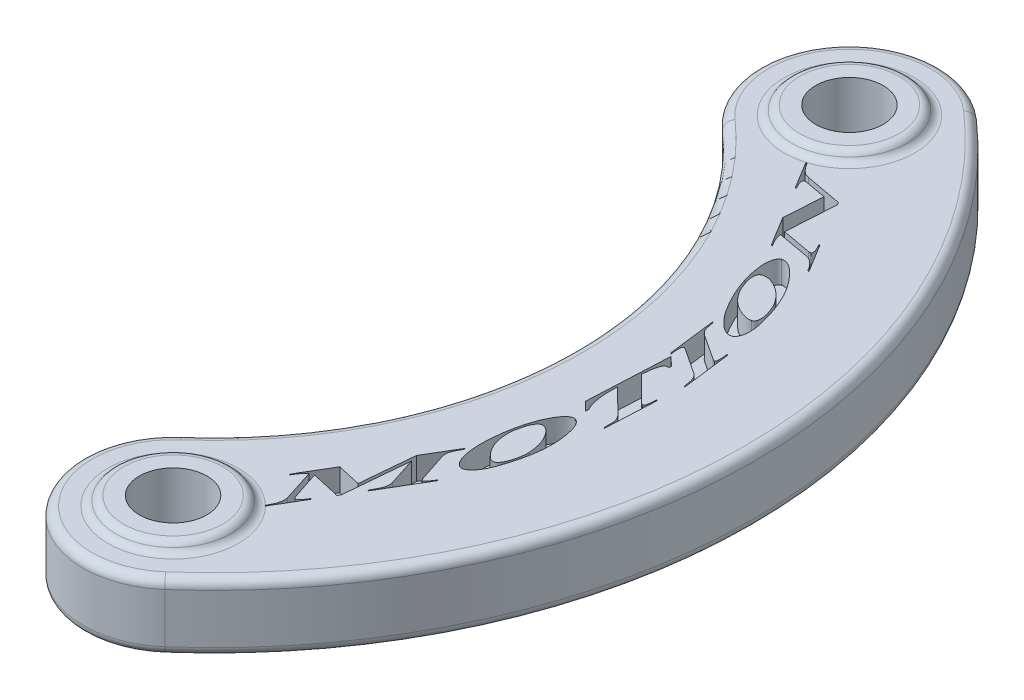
SolidWorks part; units mm, degrees
ref_plane "Front Plane" through (0, 0, 0) normal (0, 0, 1) x (1, 0, 0)
ref_plane "Top Plane" through (0, 0, 0) normal (0, 1, 0) x (1, 0, 0)
ref_plane "Right Plane" through (0, 0, 0) normal (1, 0, 0) x (0, 0, -1)
sketch "Sketch2" plane through (0, 0, 0) normal (0, 1, 0) x (-1, 0, 0)
  line L0 (0, 0) -> (100, 0) construction
  line L1 (0, 0) -> (0, -117.3978) construction
  line L2 (0, 80) -> (0, -80) construction
  line L3 (20, 80) -> (20, -80)
  line L4 (-20, 80) -> (-20, -80)
  line L6 (133.8609, 17.5) -> (145, 17.5)
  line L8 (133.8609, -17.5) -> (145, -17.5)
  line L9 (145, 17.5) -> (145, -17.5)
  line L10 (135, 0) -> (145, -17.5) construction
  line L11 (135, 0) -> (145, 17.5) construction
  line L12 (-145, 17.5) -> (-133.8609, 17.5)
  line L13 (-145, 17.5) -> (-145, -17.5)
  line L14 (-145, -17.5) -> (-133.8609, -17.5)
  line L16 (-145, 17.5) -> (-135, 0) construction
  line L17 (-145, -17.5) -> (-135, 0) construction
  arc A0 (65.9983, -75.128) -> (65.9983, 75.128) centre (0, 0) ccw construction
  arc A1 (79.198, -90.1536) -> (79.198, 90.1536) centre (0, 0) ccw
  arc A2 (52.7987, -60.1024) -> (52.7987, 60.1024) centre (0, 0) ccw
  arc A3 (52.7987, -60.1024) -> (79.198, -90.1536) centre (65.9983, -75.128) ccw
  arc A4 (79.198, 90.1536) -> (52.7987, 60.1024) centre (65.9983, 75.128) ccw
  arc A5 (-65.9983, -75.128) -> (-65.9983, 75.128) centre (0, 0) cw construction
  arc A6 (-79.198, -90.1536) -> (-79.198, 90.1536) centre (0, 0) cw
  arc A7 (-52.7987, -60.1024) -> (-52.7987, 60.1024) centre (0, 0) cw
  arc A8 (-52.7987, -60.1024) -> (-79.198, -90.1536) centre (-65.9983, -75.128) cw
  arc A9 (-79.198, 90.1536) -> (-52.7987, 60.1024) centre (-65.9983, 75.128) cw
  arc A10 (20, 80) -> (-20, 80) centre (0, 80) ccw
  arc A11 (-20, -80) -> (20, -80) centre (0, -80) ccw
  circle A12 centre (65.9983, 75.128) radius 7.5
  circle A13 centre (65.9983, -75.128) radius 7.5
  circle A14 centre (0, -80) radius 7.5
  circle A15 centre (0, 80) radius 7.5
  circle A16 centre (-65.9983, 75.128) radius 7.5
  circle A17 centre (-65.9983, -75.128) radius 7.5
  circle A18 centre (0, 0) radius 135
  point P4 (100, 0)
  point P14 (-100, 0)
  point P21 (0, 0)
  point P39 (135, 0)
  point P44 (-135, 0)
  dimension "D1" = 15
  dimension "D2" = 12.5
  dimension "D3" = 12.5
  dimension "D4" = 270
  dimension "D9" = 170
  dimension "D5" = 10
  dimension "D6" = 10
  dimension "D7" = 35
  dimension "D8" = 100
  dimension "D10" = 160
extrude "Extrude1" add sketch "Sketch2" along normal blind 15 contours A9 A6 A8 A7 A17 A16
sketch "Sketch3" plane through (0, 15, 0) normal (0, 1, 0) x (1, 0, 0)
  line L0 (0, 0) -> (76.8153, -64.0266) construction
  line L1 (0, 0) -> (74.8717, 66.289) construction
  arc A0 (65.9983, -75.128) -> (65.9983, 75.128) centre (0, 0) ccw construction
  arc A1 (76.8153, -64.0266) -> (74.8717, 66.289) centre (0, 0) ccw construction
  circle A2 centre (65.9983, 75.128) radius 7.5 construction
  circle A4 centre (65.9983, -75.128) radius 7.5 construction
  text T0 "<i><b>MOTION</b></i>" font "Times New Roman" height 7.5
  dimension "D1" = 5
  dimension "D2" = 8
extrude "Extrude2" cut sketch "Sketch3" against normal blind 5
fillet "Fillet1" radius 2 6 edges at (120, 15, 0) (50.9727, 15, -88.3277) (80, 15, 0) (65.9983, 0, -67.628) (65.9983, 0, 82.628) (50.9727, 15, 88.3277)
sketch "Sketch4" plane through (0, 15, 0) normal (0, 1, 0) x (1, 0, 0)
  circle A2 centre (65.9983, -75.128) radius 12.5
  circle A3 centre (65.9983, -75.128) radius 12.5
  circle A4 centre (65.9983, 75.128) radius 7.5 construction
  circle A5 centre (65.9983, 75.128) radius 12.5
  circle A6 centre (65.9983, 75.128) radius 12.5
  circle A7 centre (65.9983, -75.128) radius 7.5 construction
  circle A8 centre (65.9983, 75.128) radius 7.5
  circle A9 centre (65.9983, -75.128) radius 7.5
  dimension "D1" = 5
  dimension "D2" = 5
extrude "Extrude3" add sketch "Sketch4" along normal blind 2
fillet "Fillet2" radius 2 2 edges at (65.9983, 15, 87.628) (65.9983, 15, -62.628)
fillet "Fillet3" radius 2 2 edges at (65.9983, 17, 87.628) (65.9983, 17, -62.628)
fillet "Fillet4" radius 2 4 edges at (50.9727, 0, -88.3277) (80, 0, 0) (50.9727, 0, 88.3277) (120, 0, 0)
